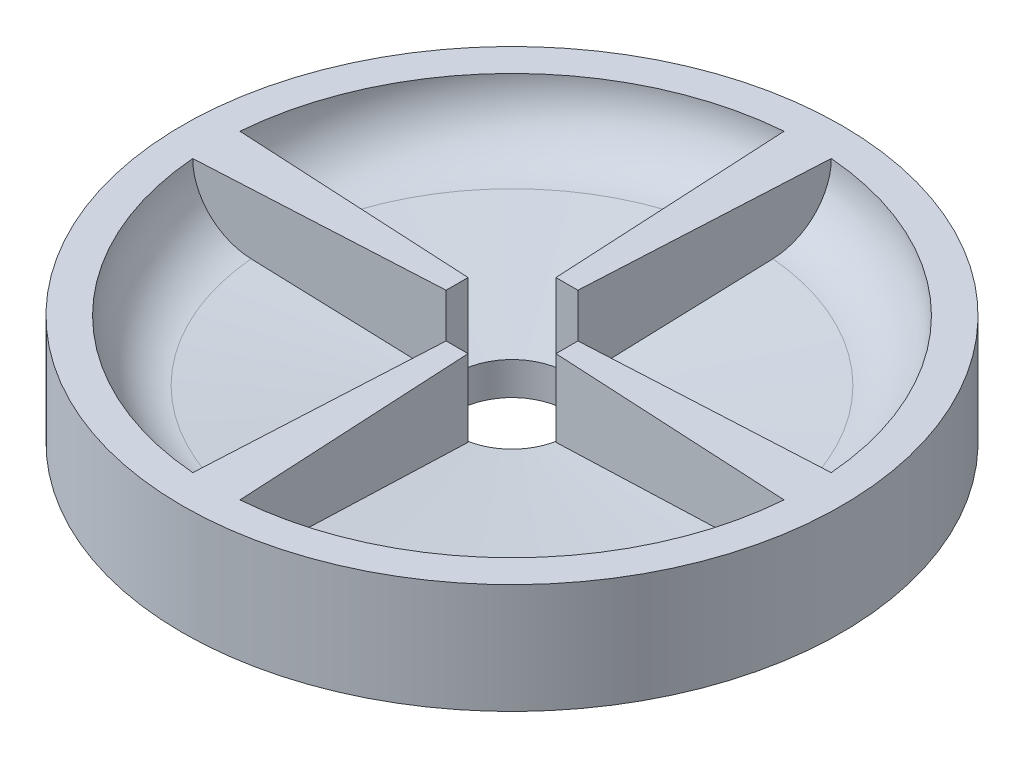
SolidWorks part; units mm, degrees
ref_plane "Front Plane" through (0, 0, 0) normal (0, 0, 1) x (1, 0, 0)
ref_plane "Top Plane" through (0, 0, 0) normal (0, 1, 0) x (1, 0, 0)
ref_plane "Right Plane" through (0, 0, 0) normal (1, 0, 0) x (0, 0, -1)
sketch "Sketch1" plane through (0, 0, 0) normal (1, 0, 0) x (0, 0, -1)
  line L0 (-5, 0) -> (-30, 0)
  line L1 (-30, 0) -> (-30, 10)
  line L2 (-30, 10) -> (-27, 10)
  line L3 (-21.9441, 4.4824) -> (-5, 3)
  line L5 (0, 0) -> (0, 18.8283) construction
  line L6 (-5, 3) -> (-5, 0)
  arc A0 (-27, 10) -> (-21.9441, 4.4824) centre (-21.4613, 10) ccw
  dimension "D2" = 30
  dimension "D5" = 3
  dimension "D1" = 5
  dimension "D3" = 10
  dimension "D4" = 5
  dimension "D6" = 3
revolve "Revolve1" add sketch "Sketch1" angle 360 about L5
sketch "Sketch3" plane through (0, 0, 0) normal (0, 0, 1) x (1, 0, 0)
  line L1 (5, 3) -> (-5, 3) construction
  line L2 (-5, 3) -> (-5, 10)
  line L3 (30, 10) -> (-30, 10) construction
  line L4 (-5, 10) -> (-27, 10)
  line L7 (-5, 3) -> (-5, 0) construction
rib "Rib1" sketch "Sketch3" sketch "Sketch3" thickness 2 extrusion direction parallel to sketch draft on yes draft angle 3 parameters "D1"=2, "D3"=3
pattern_circular "CirPattern3" count 4 over 360 about axis through (0, 0, 0) along (0, 1, 0) of "Rib1"
equation "\"D1@CirPattern3\" = \"D2@Sketch1\"/7"
